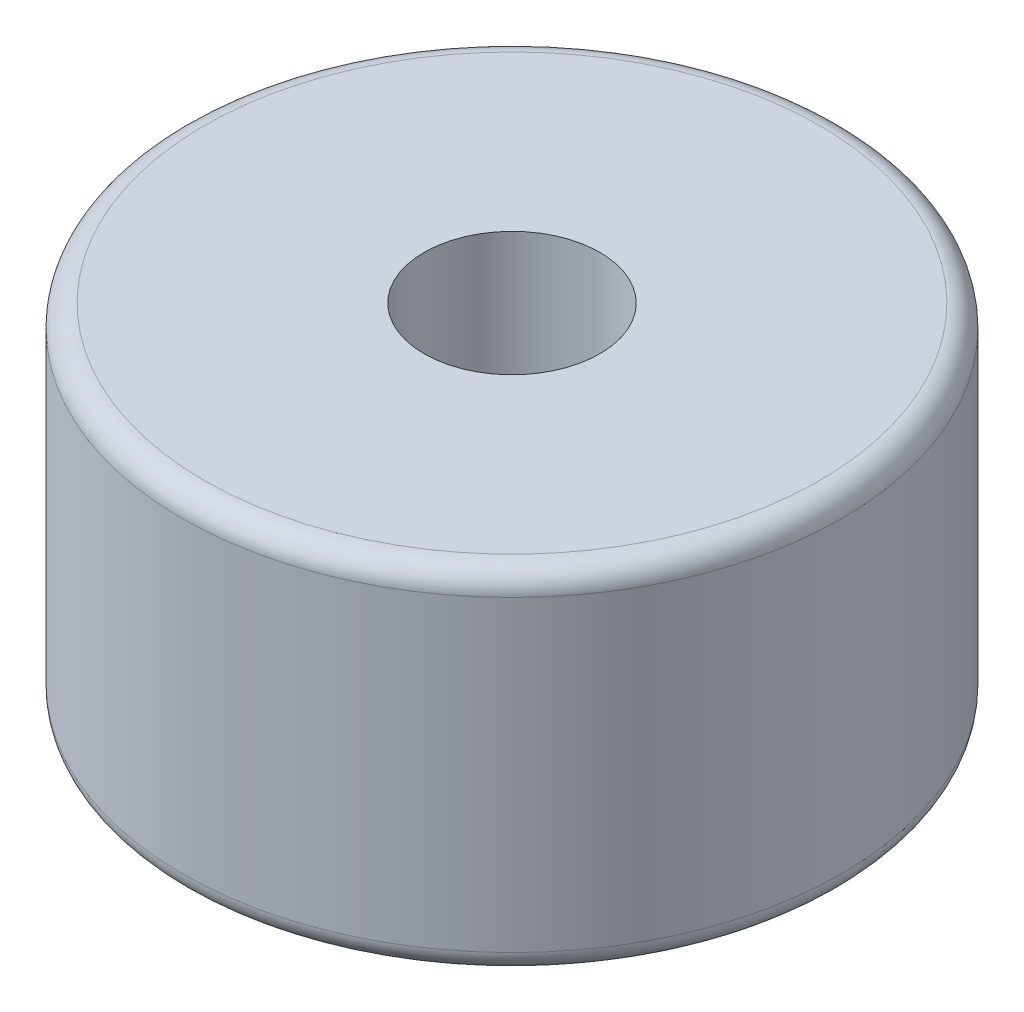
SolidWorks part; units mm, degrees
ref_plane "Front Plane" through (0, 0, 0) normal (0, 0, 1) x (1, 0, 0)
ref_plane "Top Plane" through (0, 0, 0) normal (0, 1, 0) x (1, 0, 0)
ref_plane "Right Plane" through (0, 0, 0) normal (1, 0, 0) x (0, 0, -1)
sketch "Sketch1" plane through (0, 0, 0) normal (0, 1, 0) x (1, 0, 0)
  circle A0 centre (0, 0) radius 7.5
  circle A1 centre (0, 0) radius 2
  dimension "D1" = 15
  dimension "D2" = 4
extrude "Boss-Extrude1" add sketch "Sketch1" along normal blind 8
fillet "Fillet1" radius 0.5 2 edges at (0, 0, 7.5) (0, 8, 7.5)
